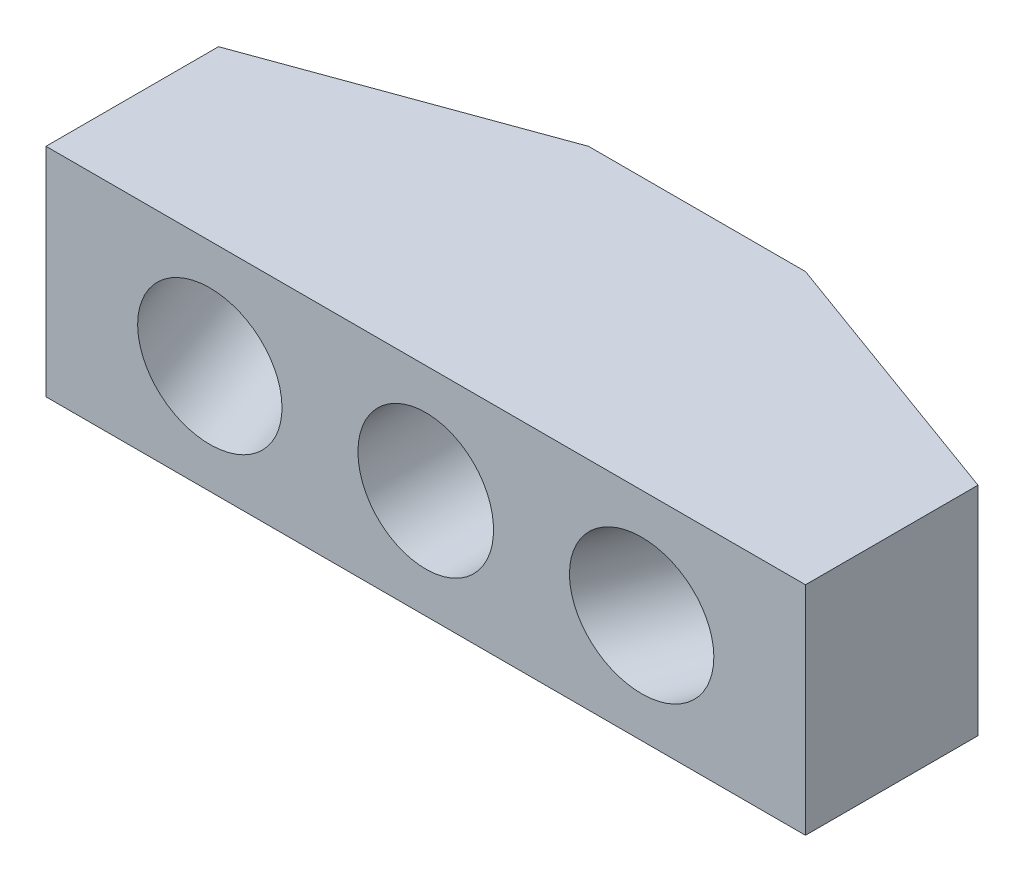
SolidWorks part; units mm, degrees
ref_plane "前视基准面" through (0, 0, 0) normal (0, 0, 1) x (1, 0, 0)
ref_plane "上视基准面" through (0, 0, 0) normal (0, 1, 0) x (1, 0, 0)
ref_plane "右视基准面" through (0, 0, 0) normal (1, 0, 0) x (0, 0, -1)
sketch "草图1" plane through (0, 0, 0) normal (0, 1, 0) x (1, 0, 0)
  line L0 (0, -8.8694) -> (0, 9.7791) construction
  line L1 (4, 6.659) -> (-4, 6.659)
  line L2 (-4, 6.659) -> (-14, 3.0193)
  line L3 (-14, 3.0193) -> (-14, -3.341)
  line L4 (-14, -3.341) -> (14, -3.341)
  line L5 (4, 6.659) -> (14, 3.0193)
  line L6 (14, 3.0193) -> (14, -3.341)
  point P9 (0, 6.659)
  point P11 (0, -3.341)
  dimension "D1" = 8
  dimension "D2" = 28
  dimension "D3" = 140
  dimension "D4" = 10
extrude "凸台-拉伸1" add sketch "草图1" along normal mid plane 8
hole_wizard "M6 螺纹孔1" positions "草图3" profile "草图2" tap size "M6" standard "GB"
sketch "草图3" plane through (0, 0, -6.659) normal (0, 0, -1) x (-1, 0, 0)
  point P0 (0, 0)
sketch "草图2" plane through (0, 0, -6.659) normal (1, 0, 0) x (0, 1, 0)
  line L0 (0, 0) -> (0, 10)
  line L1 (0, 10) -> (2.5, 10)
  line L2 (2.5, 10) -> (2.5, 0)
  line L5 (2.5, 0) -> (0, 0)
  line L11 (0, -6.35) -> (0, 107.95) construction
  dimension "通孔螺纹孔钻头直径" = 5
  dimension "通孔螺纹孔钻头深度" = 10
hole_wizard "M6 螺纹孔2" positions "草图5" profile "草图6" tap size "M6" standard "ISO"
sketch "草图5" plane through (-2.6081, 0, -7.1656) normal (-0.342, 0, -0.9397) x (-0.9397, 0, 0.342)
  line L0 (12.123, 4) -> (12.123, -4) construction
  point P0 (8.623, 0)
  dimension "D1" = 3.5
sketch "草图6" plane through (-10.7111, 0, -4.2164) normal (0, 1, 0) x (-0.9397, 0, 0.342)
  line L0 (0, 0) -> (0, 15.5533)
  line L1 (0, 15.5533) -> (2.5, 15.5533)
  line L2 (2.5, 15.5533) -> (2.5, 0)
  line L5 (2.5, 0) -> (0, 0)
  line L11 (0, -6.35) -> (0, 107.95) construction
  dimension "通孔螺纹孔钻头直径" = 5
  dimension "通孔螺纹孔钻头深度" = 15.5533
mirror "镜向2" about plane through (0, 0, 0) normal (1, 0, 0) of "M6 螺纹孔2"
